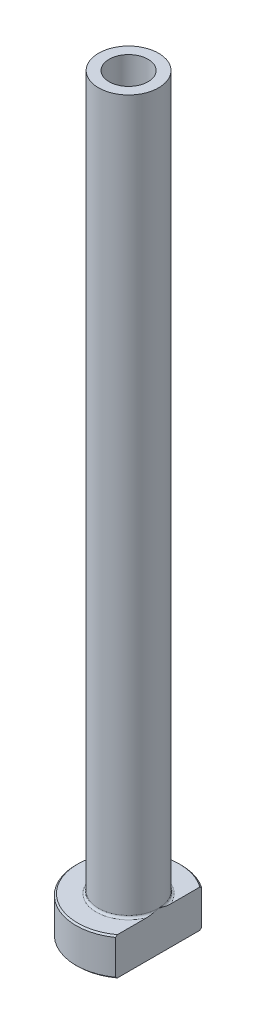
SolidWorks part; units mm, degrees
ref_plane "Front Plane" through (0, 0, 0) normal (0, 0, 1) x (1, 0, 0)
ref_plane "Top Plane" through (0, 0, 0) normal (0, 1, 0) x (1, 0, 0)
ref_plane "Right Plane" through (0, 0, 0) normal (1, 0, 0) x (0, 0, -1)
sketch "Sketch1" plane through (0, 0, 0) normal (0, 0, 1) x (1, 0, 0)
  line L0 (-2.6, 100) -> (-4, 100)
  line L1 (-4, 100) -> (-4, 5)
  line L2 (-4, 5) -> (-7, 5)
  line L3 (-7, 5) -> (-7, 0)
  line L4 (4.95, 0) -> (-4.95, 0) construction
  line L5 (-7, 0) -> (-2.85, 0)
  line L6 (-2.6, 55) -> (-2.6, 100)
  line L7 (0, 92.1877) -> (0, -15.5353) construction
  line L8 (0, -6.6) -> (0, 6.6) construction
  line L9 (-2.6, 55) -> (-2.85, 43)
  line L10 (-2.85, 43) -> (-2.85, 0)
  dimension "D1" = 0.25
  dimension "ID" = 5.2
  dimension "OD" = 8
  dimension "L" = 100
  dimension "H" = 14
  dimension "T" = 5
  dimension "N" = 45
  dimension "D2" = 12
  dimension "L-N" = 55
revolve "Revolve1" add sketch "Sketch1" angle 360 about L7
fillet "Fillet1" radius 0.3 1 edges at (0, 5, 4)
chamfer "Chamfer1" distance 0.2 angle 45 2 edges at (0, 5, 7) (0, 0, 7)
sketch "Sketch2" plane through (0, 0, 0) normal (0, -1, 0) x (1, 0, 0)
  line L0 (4, 5.7446) -> (4, -5.7446)
  circle A0 centre (0, 0) radius 7 construction
  arc A1 (4, 5.7446) -> (4, -5.7446) centre (0, 0) cw
  circle A2 centre (0, 0) radius 4 construction
extrude "Cut-Extrude1" cut sketch "Sketch2" against normal through all
chamfer "Chamfer2" distance 0.5 angle 45 1 edges at (0, 0, 2.85)
